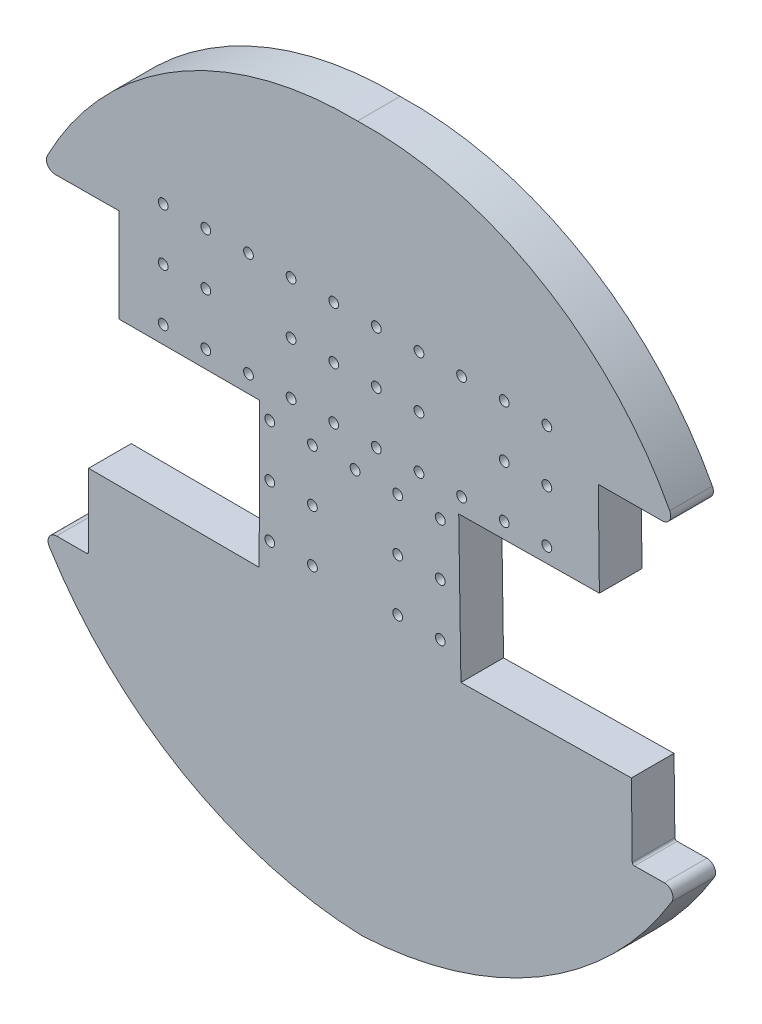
SolidWorks part; units mm, degrees
ref_plane "Front Plane" through (0, 0, 0) normal (0, 0, 1) x (1, 0, 0)
ref_plane "Top Plane" through (0, 0, 0) normal (0, 1, 0) x (1, 0, 0)
ref_plane "Right Plane" through (0, 0, 0) normal (1, 0, 0) x (0, 0, -1)
sketch "Sketch10" plane through (0, 0, 0) normal (0, 0, 1) x (1, 0, 0)
  line L0 (94.3497, -12.201) -> (108.3891, -12.201) construction
  line L1 (102.9439, -177.201) -> (101.9831, -12.201) construction
  line L2 (158.4698, -57.7629) -> (173.47, -57.6901)
  line L3 (158.726, -79.7614) -> (158.4698, -57.7629)
  line L4 (31.3922, -131.7975) -> (38.3922, -131.7975)
  line L5 (38.9119, -131.2778) -> (38.9119, -114.2778)
  line L6 (125.7282, -80.1457) -> (158.726, -79.7614)
  line L7 (38.9119, -114.2778) -> (78.9119, -114.4176)
  line L8 (126.2431, -114.142) -> (125.7282, -80.1457)
  line L9 (78.9119, -114.4176) -> (79.0308, -80.4176)
  line L10 (79.0308, -80.4176) -> (46.0308, -80.4176)
  line L11 (46.0308, -80.4176) -> (46.0308, -58.4176)
  line L12 (46.0308, -58.4176) -> (31.0308, -58.5195)
  line L13 (166.2387, -113.5363) -> (126.2431, -114.142)
  line L14 (166.4367, -130.5352) -> (166.2387, -113.5363)
  line L15 (173.9619, -130.9673) -> (166.9624, -131.0488)
  arc A1 (38.3922, -131.7975) -> (38.9119, -131.2778) centre (38.3922, -131.2778) ccw
  arc A2 (31.0308, -58.5195) -> (29.2333, -55.5962) centre (31.0171, -56.5136) cw
  arc A3 (175.6948, -134.0051) -> (102.9439, -177.201) centre (98.7633, -87.2981) cw
  arc A4 (29.2333, -55.5962) -> (101.9831, -12.201) centre (100.3759, -92.1848) cw
  arc A7 (31.3922, -131.7975) -> (29.6948, -134.8552) centre (31.3922, -133.7975) ccw
  arc A8 (29.6948, -134.8552) -> (102.9439, -177.201) centre (106.0772, -87.2556) ccw
  arc A9 (175.2333, -54.746) -> (101.9831, -12.201) centre (104.5216, -92.1607) ccw
  arc A10 (173.9619, -130.9673) -> (175.6948, -134.0051) centre (173.9852, -132.9671) cw
  arc A11 (173.47, -57.6901) -> (175.2333, -54.746) centre (173.4602, -55.6842) ccw
  arc A12 (166.9624, -131.0488) -> (166.4367, -130.5352) centre (166.9564, -130.5291) cw
  dimension "D6" = 90
  dimension "D9" = 33
  dimension "D10" = 15
  dimension "D11" = 2
  dimension "D2" = 34
  dimension "D5" = 80
  dimension "D14" = 0.5197
  dimension "D15" = 2.006
  dimension "D3" = 17
  dimension "D4" = 22
  dimension "D7" = 7
  dimension "D8" = 40
  dimension "D12" = 146
  dimension "D13" = 146
  dimension "D16" = 29.2333
  dimension "D17" = 29.6948
extrude "Boss-Extrude2" add sketch "Sketch10" along normal blind 10
shell "Shell3" thickness 2
sketch "Sketch12" plane through (0, 0, 0) normal (0, 0, 1) x (1, 0, 0)
  line L0 (101.4051, -82.1901) -> (101.4051, -84.4901) construction
  line L1 (101.4193, -83.3401) -> (101.9947, -14.2016) construction
  line L2 (101.9947, -14.2016) -> (101.9947, -177.1629) construction
  arc A3 (29.6948, -134.8552) -> (102.9439, -177.201) centre (106.0772, -87.2556) ccw construction
  circle A11 centre (56.4051, -51.8401) radius 1.15
  circle A12 centre (66.4051, -51.8401) radius 1.15
  circle A13 centre (76.4051, -51.8401) radius 1.15
  circle A14 centre (86.4051, -51.8401) radius 1.15
  circle A15 centre (96.4051, -51.8401) radius 1.15
  circle A16 centre (106.4051, -51.8401) radius 1.15
  circle A17 centre (116.4051, -51.8401) radius 1.15
  circle A18 centre (126.4051, -51.8401) radius 1.15
  circle A19 centre (136.4051, -51.8401) radius 1.15
  circle A20 centre (146.4051, -51.8401) radius 1.15
  circle A21 centre (146.4051, -64.0901) radius 1.15
  circle A22 centre (136.4051, -64.0901) radius 1.15
  circle A23 centre (116.4051, -64.0901) radius 1.15
  circle A24 centre (106.4051, -64.0901) radius 1.15
  circle A25 centre (96.4051, -64.0901) radius 1.15
  circle A26 centre (86.4051, -64.0901) radius 1.15
  circle A27 centre (66.4051, -64.0901) radius 1.15
  circle A28 centre (56.4051, -64.0901) radius 1.15
  circle A29 centre (56.4051, -76.3401) radius 1.15
  circle A30 centre (66.4051, -76.3401) radius 1.15
  circle A31 centre (76.4051, -76.3401) radius 1.15
  circle A32 centre (86.4051, -76.3401) radius 1.15
  circle A33 centre (96.4051, -76.3401) radius 1.15
  circle A34 centre (106.4051, -76.3401) radius 1.15
  circle A35 centre (116.4051, -76.3401) radius 1.15
  circle A36 centre (126.4051, -76.3401) radius 1.15
  circle A37 centre (136.4051, -76.3401) radius 1.15
  circle A38 centre (146.4051, -76.3401) radius 1.15
  circle A39 centre (81.4051, -83.3401) radius 1.15
  circle A40 centre (91.4051, -83.3401) radius 1.15
  circle A41 centre (101.4193, -83.3401) radius 1.1501
  circle A42 centre (111.4051, -83.3401) radius 1.15
  circle A43 centre (121.4051, -83.3401) radius 1.15
  circle A44 centre (121.4051, -95.5901) radius 1.15
  circle A45 centre (111.4051, -95.5901) radius 1.15
  circle A46 centre (91.4051, -95.5901) radius 1.15
  circle A47 centre (81.4051, -95.5901) radius 1.15
  circle A48 centre (81.4051, -107.8401) radius 1.15
  circle A49 centre (91.4051, -107.8401) radius 1.15
  circle A50 centre (111.4051, -107.8401) radius 1.15
  circle A51 centre (121.4051, -107.8401) radius 1.15
  dimension "D1" = 2.3
  dimension "D5" = 2.3002
  dimension "D2" = 12.25
  dimension "D3" = 40
  dimension "D4" = 24.5
  dimension "D6" = 56.4051
  dimension "D7" = 66.4051
  dimension "D8" = 76.4051
  dimension "D9" = 81.4051
  dimension "D10" = 86.4051
  dimension "D11" = 91.4051
  dimension "D12" = 96.4051
  dimension "D13" = 101.4051
  dimension "D14" = 101.4193
  dimension "D15" = 106.4051
  dimension "D16" = 111.4051
  dimension "D17" = 116.4051
  dimension "D18" = 121.4051
  dimension "D19" = 126.4051
  dimension "D20" = 136.4051
  dimension "D21" = 51.8401
  dimension "D22" = 76.3401
  dimension "D23" = 83.3401
  dimension "D24" = 95.5901
extrude "Cut-Extrude1" cut sketch "Sketch12" against normal through all and the other way through all
